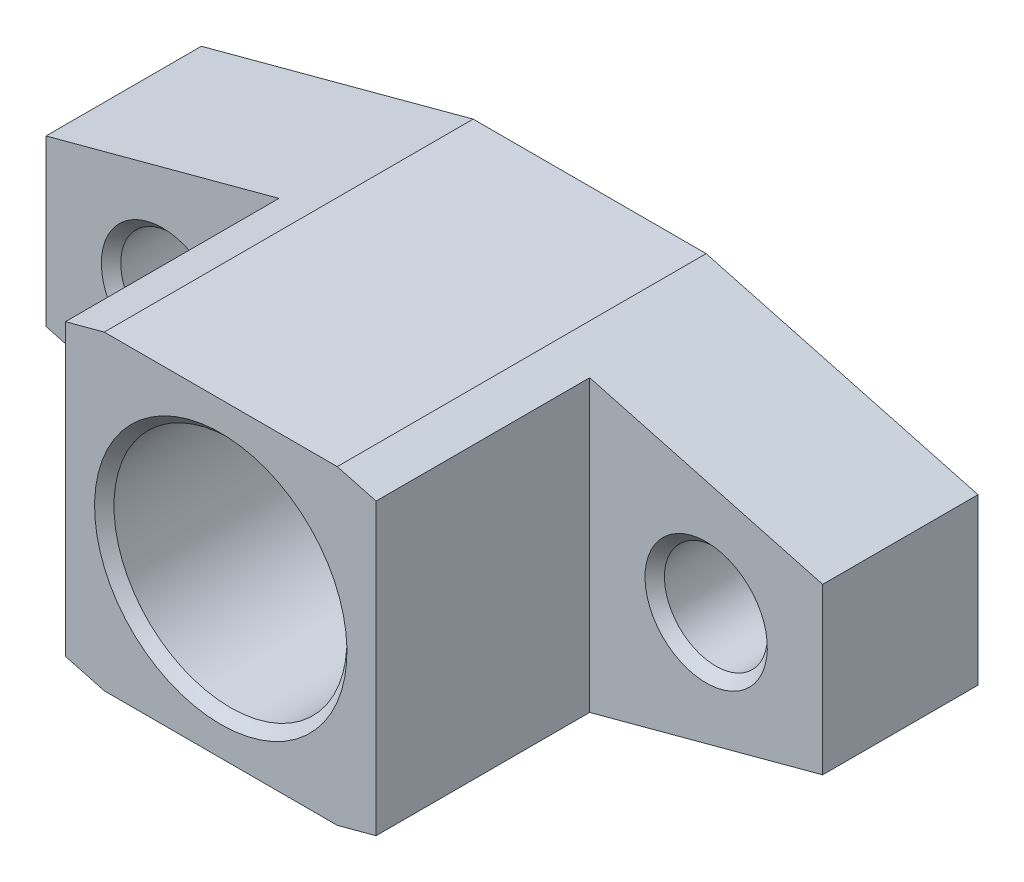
SolidWorks part; units mm, degrees
ref_plane "正面" through (0, 0, 0) normal (0, 0, 1) x (1, 0, 0)
ref_plane "平面" through (0, 0, 0) normal (0, 1, 0) x (1, 0, 0)
ref_plane "右側面" through (0, 0, 0) normal (1, 0, 0) x (0, 0, -1)
sketch "ｽｹｯﾁ1" plane through (0, 0, 0) normal (0, 1, 0) x (1, 0, 0)
  line L0 (0, 83.5749) -> (0, -71.3205) construction
  line L1 (-6, 8) -> (6, 8)
  line L2 (-6, -8) -> (6, -8)
  line L3 (-6, 8) -> (-20, 4.2487)
  line L4 (-20, 4.2487) -> (-20, -4.2487)
  line L5 (-20, -4.2487) -> (-6, -8)
  line L6 (-20, 0) -> (0, 0) construction
  line L7 (20, -4.2487) -> (6, -8)
  line L8 (20, 4.2487) -> (20, -4.2487)
  line L9 (6, 8) -> (20, 4.2487)
  circle A0 centre (14, 0) radius 2.65
  circle A2 centre (14, 0) radius 4.25 construction
  circle A3 centre (-14, 0) radius 4.25 construction
  circle A5 centre (-14, 0) radius 2.65
  circle A6 centre (0, 0) radius 8 construction
  point P7 (0, 8)
  point P17 (0, -8)
  point P19 (20, 0)
  dimension "D1" = 5.3
  dimension "D2" = 40
  dimension "D3" = 12
  dimension "D4" = 8.5
  dimension "D6" = 16
  dimension "D5" = 28
  dimension "D7" = 1.75
  dimension "D8" = 1.75
  dimension "D9" = 15
  dimension "D10" = 16
extrude "押し出し1" add sketch "ｽｹｯﾁ1" along normal blind 8
sketch "ｽｹｯﾁ3" plane through (0, 0, 0) normal (0, 1, 0) x (1, 0, 0)
  line L0 (6, -8) -> (20, -4.2487) construction
  line L1 (0, 29.9682) -> (0, -28.0118) construction
  line L2 (6, -8) -> (-6, -8)
  line L3 (8, -7.4641) -> (8, 7.4641)
  line L4 (6, 8) -> (-6, 8)
  line L5 (-8, -7.4641) -> (-8, 7.4641)
  line L8 (20, 4.2487) -> (6, 8) construction
  line L9 (-20, -4.2487) -> (-6, -8) construction
  line L10 (-6, 8) -> (-20, 4.2487) construction
  line L11 (6, -8) -> (8, -7.4641)
  line L12 (8, 7.4641) -> (6, 8)
  line L13 (-8, -7.4641) -> (-6, -8)
  line L14 (-6, 8) -> (-8, 7.4641)
  dimension "D2" = 16
extrude "押し出し2" add sketch "ｽｹｯﾁ3" along normal blind 19
sketch "ｽｹｯﾁ4" plane through (0, 0, 0) normal (0, -1, 0) x (1, 0, 0)
  circle A0 centre (0, 0) radius 6
  dimension "D1" = 12
extrude "ｶｯﾄ - 押し出し1" cut sketch "ｽｹｯﾁ4" against normal through all
chamfer "面取り1" distance 0.5 angle 45 1 edges at (0, 19, -6)
chamfer "面取り3" distance 0.5 angle 45 5 edges at (-14, 8, -2.65) (14, 8, 2.65) (14, 0, 2.65) (-14, 0, -2.65) (0, 0, -6)
move or copy body "ﾎﾞﾃﾞｨ-移動/ｺﾋﾟｰ1" bodies to move or copy 103 copy no translate (14, 0, 0)
move or copy body "ﾎﾞﾃﾞｨ-移動/ｺﾋﾟｰ2" bodies to move or copy 117 copy no rotation origin (0, 0, 0) rotation axis (1, 0, 0) rotation angle 90
